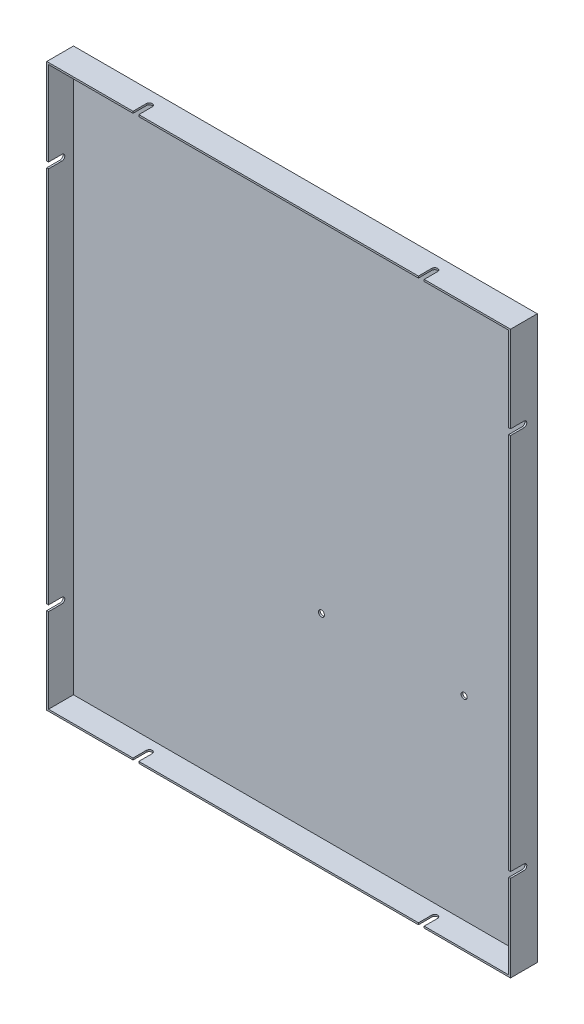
SolidWorks part; units mm, degrees
ref_plane "前基準面" through (0, 0, 0) normal (0, 0, 1) x (1, 0, 0)
ref_plane "上基準面" through (0, 0, 0) normal (0, 1, 0) x (1, 0, 0)
ref_plane "右基準面" through (0, 0, 0) normal (1, 0, 0) x (0, 0, -1)
sketch "草圖1" plane through (0, 0, 0) normal (0, 0, 1) x (1, 0, 0)
  line L1 (0, 0) -> (520, 0)
  line L2 (0, 0) -> (0, -630)
  line L3 (0, -630) -> (520, -630)
  line L4 (520, 0) -> (520, -630)
  dimension "D1" = 520
  dimension "D2" = 630
extrude "填料-伸長1" add sketch "草圖1" along normal blind 30
shell "薄殼1" thickness 2
hole_wizard "M8 螺紋孔1" positions "草圖3" profile "草圖2" tap size "M8" standard "IS"
sketch "草圖3" plane through (0, 0, 2) normal (0, 0, 1) x (1, 0, 0)
  line L1 (0, 0) -> (0, -630) construction
  line L2 (520, -630) -> (520, 0) construction
  line L3 (0, -630) -> (520, -630) construction
  point P0 (280, -410)
  point P1 (440, -410)
  dimension "D1" = 80
  dimension "D2" = 280
  dimension "D3" = 220
  dimension "D4" = 220
sketch "草圖2" plane through (280, -410, 2) normal (1, 0, 0) x (0, -1, 0)
  line L0 (0, 0) -> (0, 21.7929)
  line L1 (0, 21.7929) -> (3.4, 19.75)
  line L2 (3.4, 19.75) -> (3.4, 0)
  line L5 (3.4, 0) -> (0, 0)
  line L10 (0, 21.7929) -> (-3.4, 19.75) construction
  line L11 (0, -6.35) -> (0, 107.95) construction
  dimension "螺孔鑽直徑" = 6.8
  dimension "螺孔鑽深度" = 19.75
  dimension "導頭角度" = 118
sketch "草圖4" plane through (0, 0, 0) normal (-1, 0, 0) x (0, 0, 1)
  line L0 (30, -100) -> (15, -100) construction
  line L1 (30, 0) -> (30, -630) construction
  line L2 (30, -103.25) -> (15, -103.25)
  line L3 (30, -96.75) -> (15, -96.75)
  line L4 (15, -530) -> (30, -530) construction
  line L5 (15, -526.75) -> (30, -526.75)
  line L6 (15, -533.25) -> (30, -533.25)
  line L7 (30, 0) -> (0, 0) construction
  line L8 (30, -630) -> (0, -630) construction
  arc A0 (30, -103.25) -> (30, -96.75) centre (30, -100) ccw
  arc A1 (15, -96.75) -> (15, -103.25) centre (15, -100) ccw
  arc A2 (15, -526.75) -> (15, -533.25) centre (15, -530) ccw
  arc A3 (30, -533.25) -> (30, -526.75) centre (30, -530) ccw
  point P4 (22.5, -100)
  point P9 (22.5, -530)
  dimension "D1" = 3.25
  dimension "D2" = 3.25
  dimension "D3" = 15
  dimension "D4" = 100
  dimension "D5" = 15
  dimension "D6" = 100
extrude "除料-伸長1" cut sketch "草圖4" against normal through all
sketch "草圖5" plane through (0, 0, 0) normal (0, 1, 0) x (1, 0, 0)
  line L0 (100, -30) -> (100, -15) construction
  line L1 (520, -30) -> (0, -30) construction
  line L2 (96.75, -30) -> (96.75, -15)
  line L3 (103.25, -30) -> (103.25, -15)
  line L4 (420, -30) -> (420, -15) construction
  line L5 (416.75, -30) -> (416.75, -15)
  line L6 (423.25, -30) -> (423.25, -15)
  line L7 (0, -30) -> (0, 0) construction
  line L8 (520, -30) -> (520, 0) construction
  arc A0 (96.75, -30) -> (103.25, -30) centre (100, -30) ccw
  arc A1 (103.25, -15) -> (96.75, -15) centre (100, -15) ccw
  arc A2 (416.75, -30) -> (423.25, -30) centre (420, -30) ccw
  arc A3 (423.25, -15) -> (416.75, -15) centre (420, -15) ccw
  point P4 (100, -22.5)
  point P9 (420, -22.5)
  dimension "D1" = 3.25
  dimension "D2" = 3.25
  dimension "D3" = 15
  dimension "D4" = 15
  dimension "D5" = 100
  dimension "D6" = 100
extrude "除料-伸長2" cut sketch "草圖5" against normal through all
